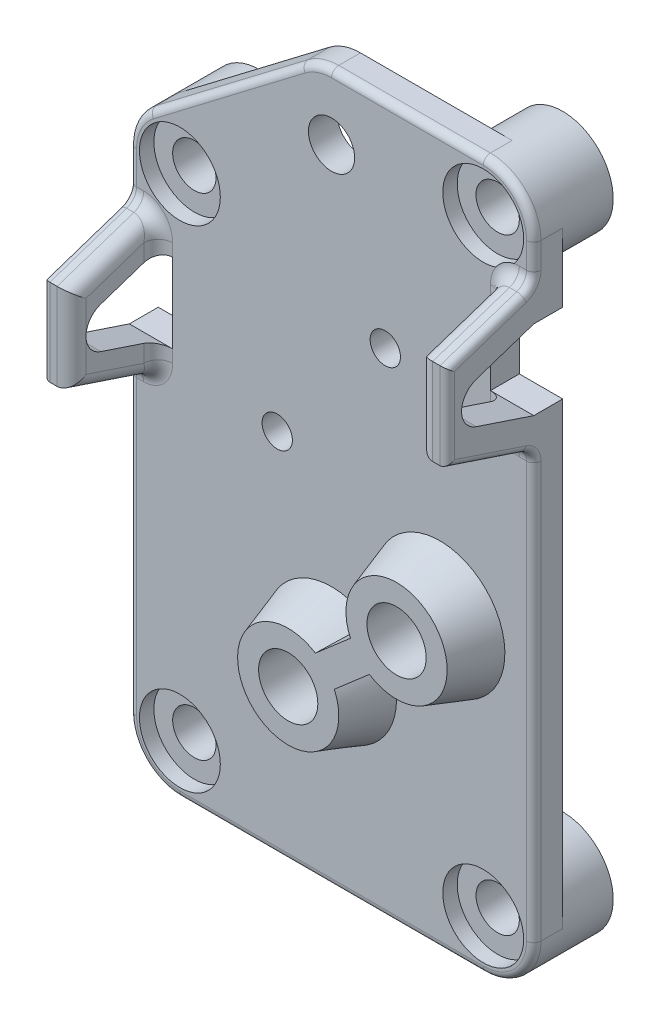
SolidWorks part; units mm, degrees
ref_plane "正面" through (0, 0, 0) normal (0, 0, 1) x (1, 0, 0)
ref_plane "平面" through (0, 0, 0) normal (0, 1, 0) x (1, 0, 0)
ref_plane "右側面" through (0, 0, 0) normal (1, 0, 0) x (0, 0, -1)
sketch "ｽｹｯﾁ1" plane through (0, 0, 0) normal (0, 0, 1) x (1, 0, 0)
  line L0 (-12.6212, 26.784) -> (-2.1212, 34.784)
  line L1 (0, 35.5) -> (10.5, 35.5)
  line L2 (-14, 24) -> (-14, -10)
  line L3 (-10.5, -13.5) -> (10.5, -13.5)
  line L4 (14, 32) -> (14, -10)
  arc A0 (0, 35.5) -> (-2.1212, 34.784) centre (0, 32) ccw
  arc A1 (-12.6212, 26.784) -> (-14, 24) centre (-10.5, 24) ccw
  arc A2 (14, 32) -> (10.5, 35.5) centre (10.5, 32) ccw
  arc A3 (14, -10) -> (10.5, -13.5) centre (10.5, -10) cw
  arc A4 (-14, -10) -> (-10.5, -13.5) centre (-10.5, -10) ccw
  point P7 (14, 35.5)
  point P16 (14, -13.5)
  point P19 (-14, -13.5)
  dimension "D5" = 7
  dimension "D6" = 7
  dimension "D8" = 3.5
  dimension "D1" = 49
  dimension "D2" = 28
  dimension "D3" = 14
  dimension "D4" = 13.5
  dimension "D7" = 24
extrude "押し出し1" add sketch "ｽｹｯﾁ1" along normal blind 2
sketch "ｽｹｯﾁ3" plane through (0, 0, 0) normal (0, 0, -1) x (-1, 0, 0)
  circle A0 centre (-10.5, 32) radius 3.5
  circle A1 centre (10.5, 24) radius 3.5
  circle A2 centre (10.5, -10) radius 3.5
  circle A3 centre (-10.5, -10) radius 3.5
  arc A4 (-10.5, 35.5) -> (-14, 32) centre (-10.5, 32) ccw construction
  arc A5 (14, 24) -> (12.6212, 26.784) centre (10.5, 24) ccw construction
  arc A6 (-14, -10) -> (-10.5, -13.5) centre (-10.5, -10) ccw construction
  arc A7 (10.5, -13.5) -> (14, -10) centre (10.5, -10) ccw construction
extrude "押し出し2" add sketch "ｽｹｯﾁ3" along normal blind 3.5
sketch "ｽｹｯﾁ10" plane through (0, 0, -3.5) normal (0, 0, -1) x (-1, 0, 0)
  circle A0 centre (-10.5, 32) radius 3
  circle A1 centre (-10.5, -10) radius 3
  circle A2 centre (10.5, -10) radius 3
  circle A3 centre (10.5, 24) radius 3
  dimension "D1" = 6
  dimension "D2" = 6
  dimension "D3" = 6
  dimension "D4" = 6
extrude "ｶｯﾄ - 押し出し1" cut sketch "ｽｹｯﾁ10" against normal blind 0.5
sketch "ｽｹｯﾁ5" plane through (0, 0, 2) normal (0, 0, 1) x (1, 0, 0)
  circle A0 centre (0, 0) radius 4.5
  circle A1 centre (7.5, 6.5) radius 4.5
  dimension "D3" = 9
  dimension "D4" = 9
  dimension "D1" = 6.5
  dimension "D2" = 7.5
extrude "押し出し3" add sketch "ｽｹｯﾁ5" along normal blind 3 draft 18.4
sketch "ｽｹｯﾁ6" plane through (0, 0, 5) normal (0, 0, 1) x (1, 0, 0)
  line L0 (7.5, 6.5) -> (0, 0) construction
  line L1 (6.8451, 7.2557) -> (-0.6549, 0.7557)
  line L2 (8.1549, 5.7443) -> (0.6549, -0.7557)
  line L3 (-0.6549, 0.7557) -> (0.6549, -0.7557)
  line L4 (6.8451, 7.2557) -> (8.1549, 5.7443)
  dimension "D1" = 1
  dimension "D2" = 1
extrude "押し出し4" add sketch "ｽｹｯﾁ6" against normal up to surface (3 mm away)
sketch "ｽｹｯﾁ1_1" plane through (0, 0, 0) normal (0, 0, -1) x (-1, 0, 0)
  circle A1 centre (3.76, 11.92) radius 3
  dimension "D4" = 6
  dimension "D5" = 11.92
  dimension "D6" = 3.76
extrude "押し出し5" add sketch "ｽｹｯﾁ1_1" along normal blind 4 draft 7.1
sketch "ｽｹｯﾁ7" plane through (0, 0, 0) normal (0, 0, -1) x (-1, 0, 0)
  line L0 (-3.72, 10.65) -> (-3.72, 20.65)
  line L1 (-3.72, 20.65) -> (6.28, 20.65)
  arc A0 (-3.72, 10.65) -> (6.28, 20.65) centre (-3.72, 20.65) ccw
  dimension "D1" = 20
  dimension "D2" = 20.65
  dimension "D3" = 3.72
extrude "ｶｯﾄ - 押し出し2" cut sketch "ｽｹｯﾁ7" along normal through all
sketch "ｽｹｯﾁ13" plane through (0, 0, 2) normal (0, 0, 1) x (1, 0, 0)
  circle A0 centre (3.72, 20.65) radius 1.05
  circle A1 centre (-3.76, 11.92) radius 1.05
  circle A2 centre (0, 31) radius 1.6
  circle A3 centre (-10.5, 24) radius 1.5
  circle A4 centre (-10.5, -10) radius 1.5
  circle A5 centre (10.5, -10) radius 1.5
  circle A6 centre (10.5, 32) radius 1.5
  circle A7 centre (0, 0) radius 2.05
  circle A8 centre (7.5, 6.5) radius 2.05
  dimension "D1" = 3
  dimension "D2" = 2.1
  dimension "D3" = 2.1
  dimension "D4" = 3
  dimension "D5" = 3
  dimension "D6" = 3
  dimension "D7" = 3.2
  dimension "D8" = 4.1
  dimension "D9" = 4.1
  dimension "D10" = 31
extrude "ｶｯﾄ - 押し出し3" cut sketch "ｽｹｯﾁ13" against normal through all and the other way through all
sketch "ｽｹｯﾁ14" plane through (14, 0, 0) normal (1, 0, 0) x (0, 0, -1)
  line L0 (-18.6014, 24.5) -> (16.1982, 24.5) construction
  line L1 (-2, 29.5) -> (-8, 27.5)
  line L2 (-2, -10) -> (-2, 32) construction
  line L3 (-8, 27.5) -> (-8, 21.5)
  line L4 (-8, 21.5) -> (-2, 19.5)
  line L5 (-2, 19.5) -> (-2, 21.7522)
  line L6 (-2, 21.7522) -> (-5.9743, 23.077)
  line L7 (-2, 29.5) -> (-2, 27.2478)
  line L8 (-2, 27.2478) -> (-5.9743, 25.923)
  arc A0 (-5.9743, 25.923) -> (-5.9743, 23.077) centre (-5.5, 24.5) ccw
  dimension "D7" = 1.5
  dimension "D1" = 24.5
  dimension "D2" = 5
  dimension "D3" = 5
  dimension "D4" = 3
  dimension "D5" = 3
  dimension "D6" = 3.5
  dimension "D8" = 6
extrude "押し出し6" add sketch "ｽｹｯﾁ14" against normal blind 2
sketch "ｽｹｯﾁ15" plane through (14, 0, 0) normal (1, 0, 0) x (0, 0, -1)
  line L0 (-5.9743, 25.923) -> (-2, 27.2478) construction
  line L1 (-2, 27.2478) -> (0, 27.2478)
  line L2 (-2, 27.2478) -> (-2, 21.7522)
  line L3 (-2, 21.7522) -> (0, 21.7522)
  line L4 (0, 27.2478) -> (0, 21.7522)
  line L5 (-2, 21.7522) -> (-2, 27.2478) construction
  line L6 (0, 20.5) -> (0, 27.5) construction
extrude "ｶｯﾄ - 押し出し4" cut sketch "ｽｹｯﾁ15" against normal blind 3
sketch "ｽｹｯﾁ16" plane through (-14, 0, 0) normal (-1, 0, 0) x (0, 0, 1)
  line L0 (-11.6083, 16) -> (11.2967, 16) construction
  line L1 (2, 21) -> (8, 19)
  line L2 (2, 24) -> (2, -10) construction
  line L3 (2, 19.5) -> (2, 21.7522) construction
  line L4 (8, 19) -> (8, 13)
  line L5 (8, 13) -> (2, 11)
  line L6 (2, 11) -> (2, 13.2522)
  line L7 (2, 13.2522) -> (5.9743, 14.577)
  line L8 (2, 21) -> (2, 18.7478)
  line L9 (2, 18.7478) -> (5.9743, 17.423)
  arc A0 (5.9743, 17.423) -> (5.9743, 14.577) centre (5.5, 16) cw
  dimension "D6" = 1.5
  dimension "D1" = 5
  dimension "D2" = 5
  dimension "D3" = 16
  dimension "D4" = 3
  dimension "D5" = 3
  dimension "D7" = 6
  dimension "D8" = 3.5
extrude "押し出し7" add sketch "ｽｹｯﾁ16" against normal blind 2
sketch "ｽｹｯﾁ17" plane through (-14, 0, 0) normal (-1, 0, 0) x (0, 0, 1)
  line L0 (0, 24) -> (0, -10) construction
  line L1 (2, 18.7478) -> (0, 18.7478)
  line L2 (2, 18.7478) -> (2, 13.2522)
  line L3 (2, 13.2522) -> (0, 13.2522)
  line L4 (0, 18.7478) -> (0, 13.2522)
extrude "ｶｯﾄ - 押し出し5" cut sketch "ｽｹｯﾁ17" against normal blind 3
fillet "ﾌｨﾚｯﾄ1" radius 1 14 edges at (13, 19.5, 2) (13, 29.5, 2) (-13, 11, 2) (-13, 21, 2) (12, 20.6261, 2) (12, 20.5, 5) (12, 24.5, 8) (12, 28.5, 5) (12, 28.3739, 2) (-12, 12.1261, 2) (-12, 12, 5) (-12, 16, 8) (-12, 20, 5) (-12, 19.8739, 2)
sketch "ｽｹｯﾁ18" plane through (0, 0, 2) normal (0, 0, 1) x (1, 0, 0)
  circle A0 centre (-10.5, 24) radius 2.8
  circle A1 centre (10.5, 32) radius 2.8
  circle A2 centre (10.5, -10) radius 2.8
  circle A3 centre (-10.5, -10) radius 2.8
  dimension "D1" = 5.6
  dimension "D2" = 5.6
  dimension "D3" = 5.6
  dimension "D4" = 5.6
extrude "ｶｯﾄ - 押し出し6" cut sketch "ｽｹｯﾁ18" against normal blind 1
fillet "ﾌｨﾚｯﾄ2" radius 0.5 22 edges at (14, 28.386, 5.3419) (14, 29.636, 2.1888) (14, 31.1104, 2) (12.9749, 34.4749, 2) (5.25, 35.5, 2) (-1.1194, 35.3162, 2) (-14, 19.886, 5.3419) (-14, 21.136, 2.1888) (-14, 22.8604, 2) (-13.6364, 25.5534, 2) (-14, 12.114, 5.3419) (-14, 10.864, 2.1888) (-14, 0.1396, 2) (-12.9749, -12.4749, 2) (14, 20.614, 5.3419) (14, 19.364, 2.1888) (14, 4.3896, 2) (12.9749, -12.4749, 2) (-7.3712, 30.784, 2) (-14, 16, 8) (0, -13.5, 2) (14, 24.5, 8)
